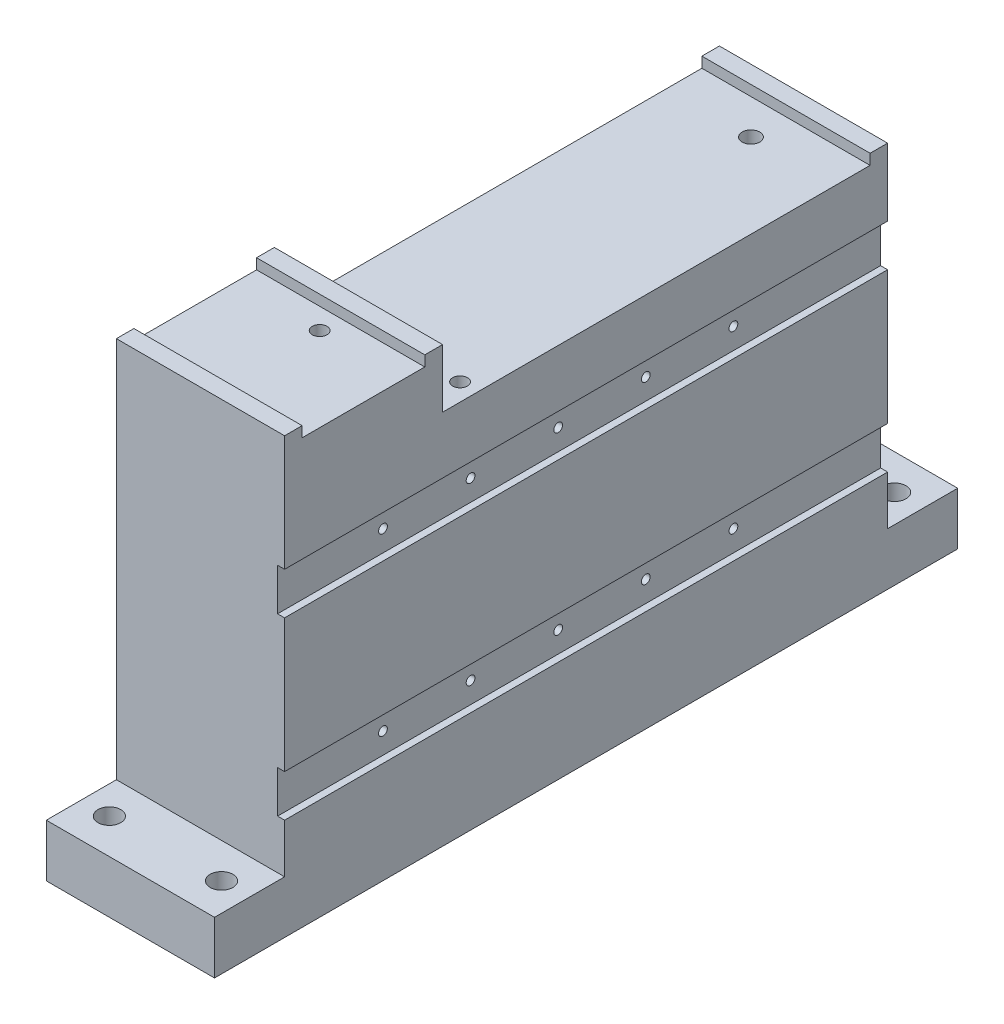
SolidWorks part; units mm, degrees
ref_plane "前视基准面" through (0, 0, 0) normal (0, 0, 1) x (1, 0, 0)
ref_plane "上视基准面" through (0, 0, 0) normal (0, 1, 0) x (1, 0, 0)
ref_plane "右视基准面" through (0, 0, 0) normal (1, 0, 0) x (0, 0, -1)
sketch "草图1" plane through (0, 0, 0) normal (0, 0, 1) x (1, 0, 0)
  line L0 (48, 0) -> (48, 29)
  line L1 (0, 0) -> (0, 124)
  line L2 (0, 0) -> (48, 0)
  line L3 (0, 124) -> (48, 124)
  line L4 (46, 91) -> (48, 91)
  line L5 (46, 79) -> (48, 79)
  line L6 (46, 41) -> (48, 41)
  line L7 (46, 29) -> (48, 29)
  line L8 (46, 29) -> (46, 41)
  line L9 (46, 79) -> (46, 91)
  line L10 (48, 41) -> (48, 79)
  line L11 (48, 91) -> (48, 124)
extrude "凸台-拉伸1" add sketch "草图1" along normal blind 212.0716
sketch "草图2" plane through (0, 124, 0) normal (0, 1, 0) x (1, 0, 0)
  circle A0 centre (8, -202.0716) radius 3.25
  circle A1 centre (40, -202.0716) radius 3.25
  circle A2 centre (40, -10) radius 3.25
  circle A3 centre (8, -10) radius 3.25
extrude "切除-拉伸1" cut sketch "草图2" against normal blind 212.0716
sketch "草图3" plane through (48, 0, 0) normal (1, 0, 0) x (0, 0, -1)
  line L0 (-147, 107.28) -> (-25, 107.28)
  line L1 (-25, 107.28) -> (-25, 110.28)
  line L2 (-20, 15) -> (-20, 110.28)
  line L3 (-187.0716, 121) -> (-187.0716, 124)
  line L4 (-187.0716, 121) -> (-152.0716, 121)
  line L5 (-192.0716, 15) -> (-192.0716, 124)
  line L6 (-152.0716, 121) -> (-152.0716, 124)
  line L7 (-147, 107.28) -> (-147, 124)
  line L8 (-192.0716, 124) -> (-187.0716, 124)
  line L9 (-212.0716, 0) -> (0, 0)
  line L10 (-212.0716, 0) -> (-212.0716, 15)
  line L11 (0, 0) -> (0, 15)
  line L12 (-212.0716, 15) -> (-192.0716, 15)
  line L13 (-25, 110.28) -> (-20, 110.28)
  line L14 (-152.0716, 124) -> (-147, 124)
  line L15 (-20, 15) -> (0, 15)
  circle A0 centre (-62, 35) radius 1.25
  circle A1 centre (-87, 35) radius 1.25
  circle A2 centre (-112, 35) radius 1.25
  circle A3 centre (-137, 35) radius 1.25
  circle A4 centre (-162, 35) radius 1.25
  circle A5 centre (-162, 85) radius 1.25
  circle A6 centre (-137, 85) radius 1.25
  circle A7 centre (-112, 85) radius 1.25
  circle A8 centre (-87, 85) radius 1.25
  circle A9 centre (-62, 85) radius 1.25
extrude "切除-拉伸2" cut sketch "草图3" against normal blind 212.0716 flip side to cut
sketch "草图4" plane through (0, 107.28, 0) normal (0, 1, 0) x (1, 0, 0)
  circle A0 centre (24, -35) radius 2.5
  circle A1 centre (5, -137) radius 2.1
  circle A2 centre (43, -137) radius 2.1
extrude "切除-拉伸3" cut sketch "草图4" against normal blind 15
sketch "草图5" plane through (0, 121, 0) normal (0, 1, 0) x (1, 0, 0)
  circle A0 centre (24, -158.0716) radius 2.1
extrude "切除-拉伸4" cut sketch "草图5" against normal blind 15
